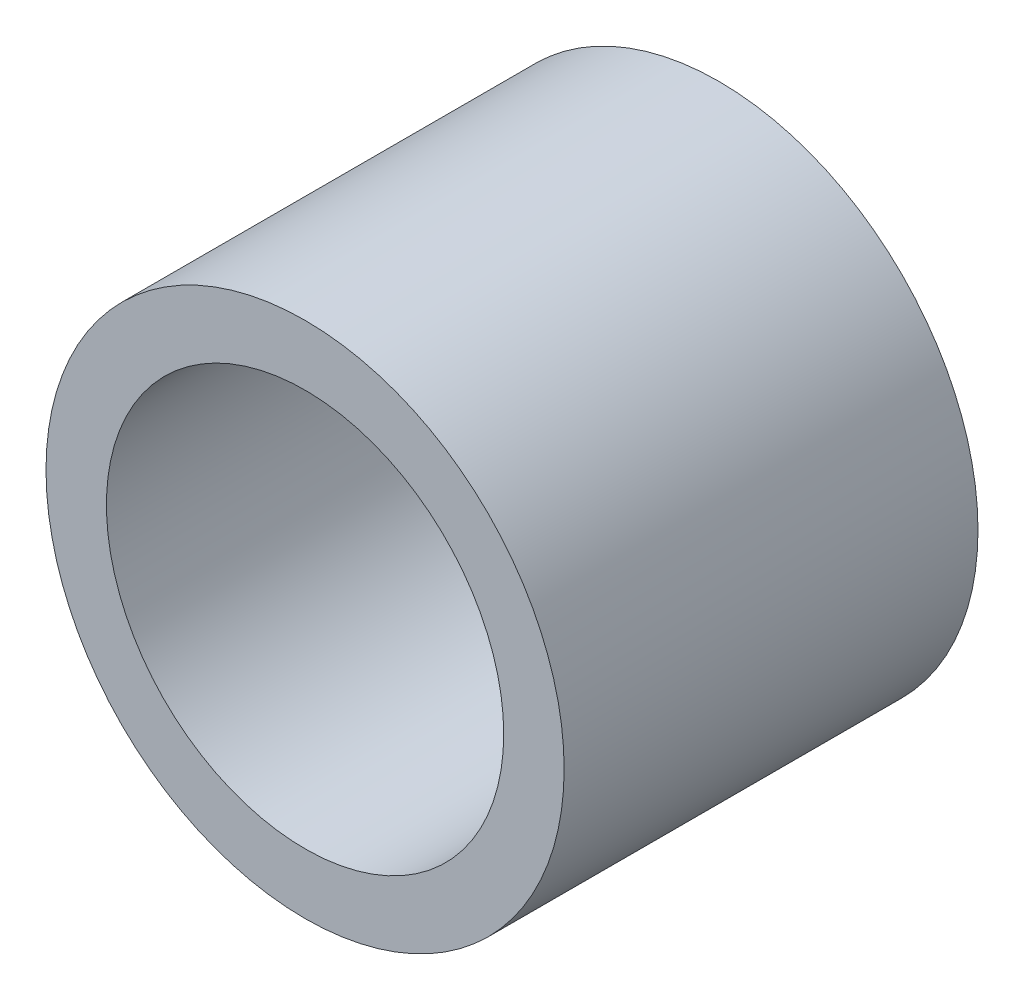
SolidWorks part; units mm, degrees
ref_plane "Front Plane" through (0, 0, 0) normal (0, 0, 1) x (1, 0, 0)
ref_plane "Top Plane" through (0, 0, 0) normal (0, 1, 0) x (1, 0, 0)
ref_plane "Right Plane" through (0, 0, 0) normal (1, 0, 0) x (0, 0, -1)
sketch "Sketch1" plane through (0, 0, 0) normal (0, 0, 1) x (1, 0, 0)
  circle A0 centre (0, 0) radius 3.9751
  circle A1 centre (0, 0) radius 2.4257
  dimension "D1" = 7.9502
  dimension "ID" = 4.8514
extrude "Extrude1" add sketch "Sketch1" along normal mid plane 6.35
sketch "Sketch2" plane through (0, 0, 0) normal (1, 0, 0) x (0, 0, -1)
  line L0 (-3.175, -2.4257) -> (3.175, -2.4257) construction
  line L3 (3.175, 2.4257) -> (-3.175, 2.4257) construction
  line L5 (-3.175, -2.4257) -> (3.175, -2.4257)
  line L6 (3.175, 2.4257) -> (-3.175, 2.4257)
sketch "Sketch4" plane through (0, 0, 3.175) normal (0, 0, 1) x (1, 0, 0)
  line L0 (0, 0) -> (-1.7152, 1.7152)
  line L1 (0, -3.5065) -> (0, 3.5065) construction
  circle A0 centre (0, 0) radius 2.4257 construction
  dimension "D1" = 45
sketch "Sketch5" plane through (0, 0, 3.175) normal (0, 0, 1) x (1, 0, 0)
  circle A0 centre (0, 0) radius 3.048
  dimension "D1" = 6.096
extrude "Cut-Extrude1" cut sketch "Sketch5" against normal through all
